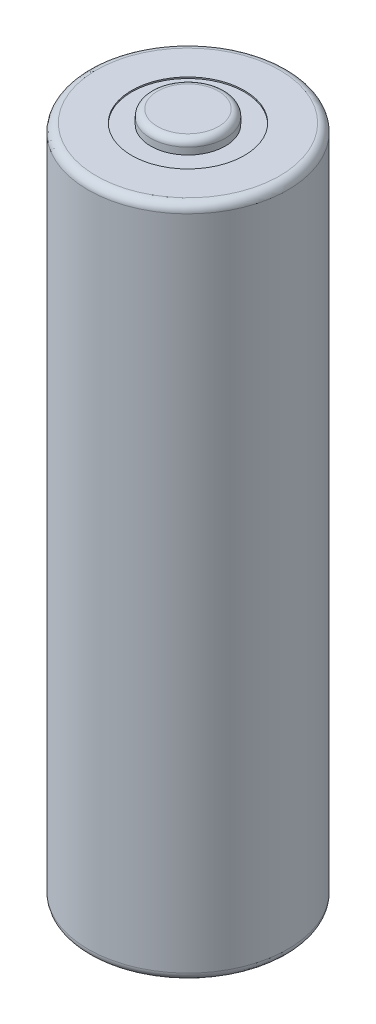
SolidWorks part; units mm, degrees
ref_plane "Front Plane" through (0, 0, 0) normal (0, 0, 1) x (1, 0, 0)
ref_plane "Top Plane" through (0, 0, 0) normal (0, 1, 0) x (1, 0, 0)
ref_plane "Right Plane" through (0, 0, 0) normal (1, 0, 0) x (0, 0, -1)
sketch "Sketch1" plane through (0, 0, 0) normal (0, 0, 1) x (1, 0, 0)
  line L0 (0, 0) -> (0, 50.5) construction
  line L1 (0, 50.5) -> (2.75, 50.5)
  line L2 (2.75, 50.5) -> (2.75, 49.5)
  line L3 (2.75, 49.5) -> (7.25, 49.5)
  line L4 (7.25, 49.5) -> (7.25, 0.1)
  line L5 (7.25, 0.1) -> (3.5, 0.1)
  line L6 (3.5, 0.1) -> (2.5, 0)
  line L7 (2.5, 0) -> (0, 0)
  line L8 (0, 0) -> (0, 50.5)
  dimension "D1" = 14.5
  dimension "D2" = 5.5
  dimension "D3" = 7
  dimension "D4" = 0.1
  dimension "D5" = 1
  dimension "D6" = 50.5
  dimension "D7" = 5
revolve "Revolve1" add sketch "Sketch1" angle 360 about L0
fillet "Fillet1" radius 0.5 3 edges at (0, 50.5, -2.75) (0, 0.1, -7.25) (0, 49.5, -7.25)
sketch "Sketch2" plane through (0, 0, 0) normal (0, 0, 1) x (1, 0, 0)
  line L4 (7.25, 0.6) -> (7.25, 49)
  line L5 (6.75, 49.5) -> (4.25, 49.5)
  line L6 (6.75, 0.1) -> (4.25, 0.1)
  line L7 (0, 0) -> (0, 37.0733) construction
  line L8 (4.25, 0.1) -> (4.25, 49.5)
  arc A0 (6.75, 0.1) -> (7.25, 0.6) centre (6.75, 0.6) ccw construction
  arc A1 (7.25, 49) -> (6.75, 49.5) centre (6.75, 49) ccw construction
  arc A2 (6.75, 0.1) -> (7.25, 0.6) centre (6.75, 0.6) ccw
  arc A3 (7.25, 49) -> (6.75, 49.5) centre (6.75, 49) ccw
  dimension "D1" = 2.5
revolve "Wrapper" add sketch "Sketch2" angle 360 about L7
